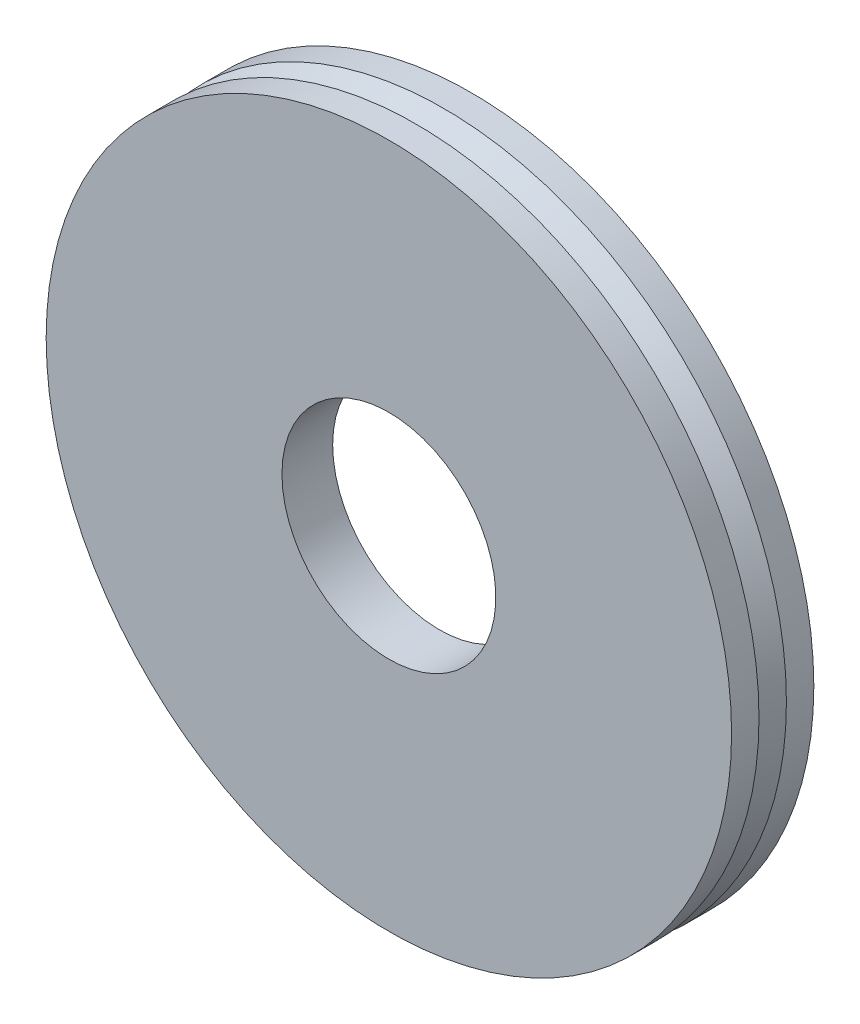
SolidWorks part; units mm, degrees
ref_plane "Plan de face" through (0, 0, 0) normal (0, 0, 1) x (1, 0, 0)
ref_plane "Plan de dessus" through (0, 0, 0) normal (0, 1, 0) x (1, 0, 0)
ref_plane "Plan de droite" through (0, 0, 0) normal (1, 0, 0) x (0, 0, -1)
sketch "Esquisse1" plane through (0, 0, 0) normal (1, 0, 0) x (0, 0, -1)
  line L0 (0, 0) -> (-7.9609, 0) construction
  line L1 (1.85, 3.9) -> (1.85, 5.9)
  line L2 (1.85, 5.9) -> (3, 5.9)
  line L5 (0, 3.9) -> (0, 12.5)
  line L6 (0, 12.5) -> (1, 12.5)
  line L7 (1, 12.5) -> (1, 12)
  line L8 (1, 12) -> (2, 12.5)
  line L9 (3, 12.5) -> (3, 5.9)
  line L12 (1.85, 3.9) -> (0, 3.9)
  line L13 (3, 12.5) -> (2, 12.5)
  dimension "D1" = 7.8
  dimension "D2" = 11.8
  dimension "D3" = 1.15
  dimension "D5" = 25
  dimension "D6" = 1
  dimension "D7" = 3
  dimension "D8" = 24
  dimension "D11" = 1
revolve "Révolution1" add sketch "Esquisse1" angle 360 about L0
